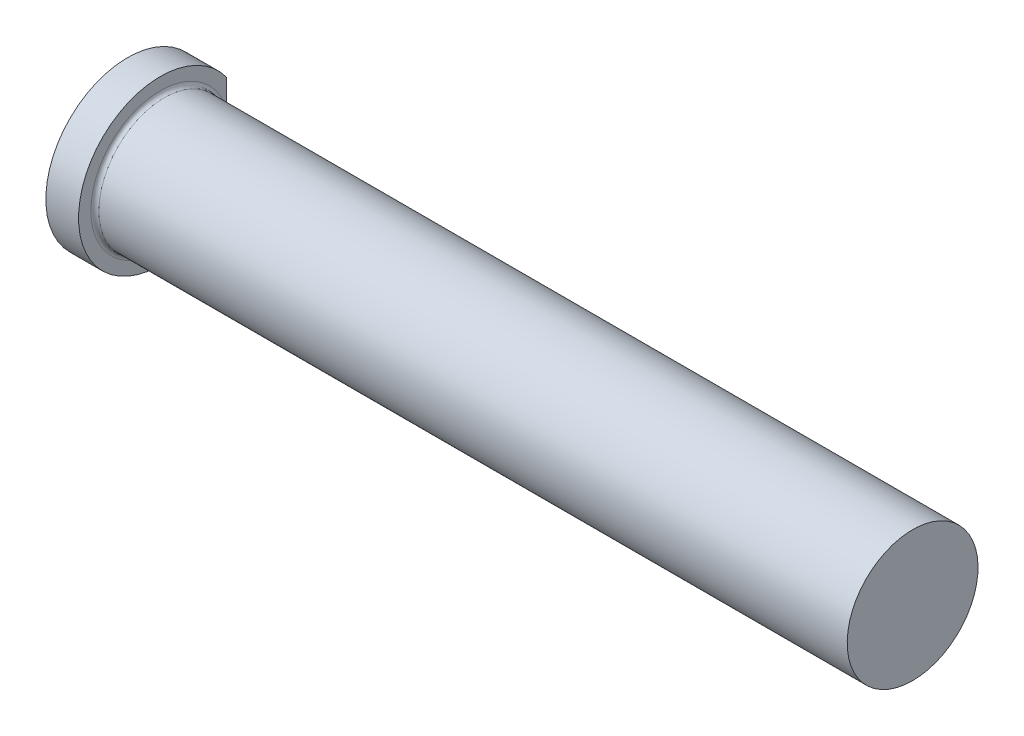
SolidWorks part; units mm, degrees
ref_plane "Front Plane" through (0, 0, 0) normal (0, 0, 1) x (1, 0, 0)
ref_plane "Top Plane" through (0, 0, 0) normal (0, 1, 0) x (1, 0, 0)
ref_plane "Right Plane" through (0, 0, 0) normal (1, 0, 0) x (0, 0, -1)
sketch "Sketch1" plane through (0, 0, 0) normal (0, 0, 1) x (1, 0, 0)
  line L0 (0, 0) -> (0, 15.875)
  line L1 (0, 15.875) -> (6.35, 15.875)
  line L2 (6.35, 15.875) -> (6.35, 13.4874)
  line L3 (7.1374, 12.7) -> (152.4, 12.7)
  line L4 (152.4, 12.7) -> (152.4, 0)
  line L5 (152.4, 0) -> (0, 0)
  line L6 (152.4, 0) -> (0, 0) construction
  line L7 (0, 0) -> (-10.4771, 0) construction
  line L8 (152.4, 0) -> (1002.3976, 0) construction
  line L9 (7.1374, 12.7) -> (-7.9138, 12.7) construction
  arc A0 (7.1374, 12.7) -> (6.35, 13.4874) centre (7.1374, 13.4874) cw
  dimension "D1" = 0.7874
  dimension "HeadDia" = 31.75
  dimension "HeadThickness" = 6.35
  dimension "PinDia" = 25.4
  dimension "overall" = 152.4
revolve "PIN" add sketch "Sketch1" angle 360 about L6
ref_plane "Plane1" through (79.7687, 0, -12.7) normal (0, 0, -1) x (0, -1, 0)
ref_plane "CutPlane" through (0, 0, -12.8778) normal (0, 0, -1) x (-1, 0, 0)
other "SurfaceCut1"
